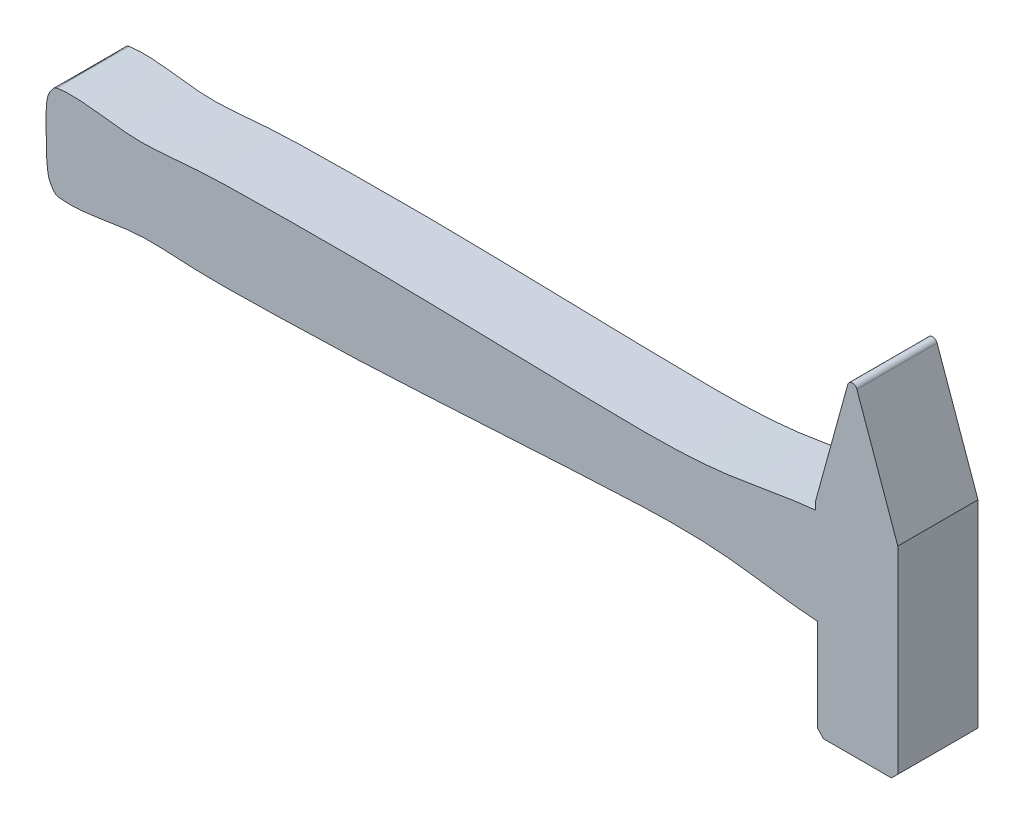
SolidWorks part; units mm, degrees
ref_plane "Plan de face" through (0, 0, 0) normal (0, 0, 1) x (1, 0, 0)
ref_plane "Plan de dessus" through (0, 0, 0) normal (0, 1, 0) x (1, 0, 0)
ref_plane "Plan de droite" through (0, 0, 0) normal (1, 0, 0) x (0, 0, -1)
sketch "Esquisse1" plane through (0, 0, 0) normal (0, 0, 1) x (1, 0, 0)
  line L0 (-388.3824, 105.6296) -> (139.5327, 89.0392) construction
  line L1 (0, 0) -> (0, 38.5055)
  line L2 (-284.6368, 70.5412) -> (-284.0031, 36.3588) construction
  line L3 (-284.32, 53.45) -> (83.1514, 59.7883) construction
  line L4 (0, 0) -> (2.5793, -2.6388)
  line L5 (2.5793, -2.6388) -> (30.8284, -2.6388)
  line L6 (30.8284, -2.6388) -> (33.5282, 0)
  line L7 (33.5282, 0) -> (33.5282, 82.3612)
  line L8 (33.5282, 82.3612) -> (14.3545, 136.3624)
  line L9 (14.3545, 136.3624) -> (-0.6845, 81.6961)
  line L10 (-0.6845, 81.6961) -> (-0.6845, 78.1908)
  spline S0 degree 3 poles (0, 38.5055) (-12.9929, 39.2651) (-32.8726, 43.1724) (-62.3228, 43.9918) (-92.949, 42.4953) (-137.6271, 40.0452) (-185.3014, 37.0157) (-228.8924, 35.9277) (-258.7667, 35.3214) (-283.1784, 37.5067) (-301.2471, 33.5502) (-312.0118, 32.8896) (-316.1547, 33.3659) knots 0 0 0 0 0.123174 0.190952 0.278444 0.413498 0.614695 0.730776 0.826275 0.897915 0.961055 1 1 1 1
  spline S1 degree 3 poles (-321.2186, 52.8135) (-321.2038, 49.4201) (-321.1659, 44.1912) (-320.2878, 37.7067) (-318.2147, 34.6903) (-316.9069, 33.4524) (-316.1547, 33.3659) knots 0 0 0 0 0.479345 0.759128 0.899247 1 1 1 1
  spline S2 degree 3 poles (-0.6845, 78.1908) (-13.6435, 76.9835) (-33.3766, 72.393) (-62.7811, 70.5584) (-93.4407, 70.9979) (-138.1766, 71.9057) (-185.927, 73.2892) (-229.5297, 72.8734) (-259.4071, 72.449) (-283.7289, 69.4231) (-301.9233, 72.7541) (-312.7044, 73.0431) (-316.8284, 72.4242) knots 0 0 0 0 0.123174 0.190952 0.278444 0.413498 0.614695 0.730776 0.826275 0.897915 0.961055 1 1 1 1
  spline S3 degree 3 poles (-321.2186, 52.8135) (-321.3208, 56.2054) (-321.4633, 61.4325) (-320.8093, 67.9435) (-318.8415, 71.0295) (-317.5772, 72.3118) (-316.8284, 72.4242) knots 0 0 0 0 0.479345 0.759128 0.899247 1 1 1 1
  point P48 (14.3545, 136.3624)
  point P49 (0, 0)
  dimension "D1" = 85
extrude "Boss.-Extru.1" add sketch "Esquisse1" along normal blind 33.4
fillet "Congé1" radius 2 1 edges at (14.3545, 136.3624, 16.7)
sketch "Esquisse3" plane through (0, 0, 0) normal (0, 0, -1) x (-1, 0, 0)
  line L0 (0.6845, 78.1908) -> (0, 38.5055)
  spline S0 degree 3 poles (1821.4053, 1371.5832) (234.0768, 135.7105) (329.4558, 105.4099) (320.2878, 37.7067) (311.9389, 25.5588) (284.8584, 23.9977) (-421.6905, 1891.8404) knots -8.489598 -8.489598 -8.489598 -8.489598 0.479345 0.759128 0.899247 2.576173 2.576173 2.576173 2.576173 only from (321.2186, 52.8135) to (316.1547, 33.3659) construction
  spline S1 degree 3 poles (-484.7359, -1759.6556) (285.8724, 82.8663) (312.8842, 80.3723) (320.8093, 67.9435) (327.6371, -0.036) (231.2688, -27.0292) (1775.056, -1316.9272) knots -1.57622 -1.57622 -1.57622 -1.57622 0.100753 0.240872 0.520655 9.489642 9.489642 9.489642 9.489642 only from (316.8284, 72.4242) to (321.2186, 52.8135) construction
  spline S2 degree 3 poles (565.7215, 2015.0683) (436.0771, 76.8606) (360.1971, 20.6419) (283.1784, 37.5067) (258.7667, 35.3214) (228.8924, 35.9277) (185.3014, 37.0157) (137.6271, 40.0452) (92.949, 42.4953) (62.3228, 43.9918) (-71.2563, 40.275) (-183.5802, -89.9499) (-497.8856, 1967.6109) knots -0.566785 -0.566785 -0.566785 -0.566785 0.038945 0.102085 0.173725 0.269224 0.385305 0.586502 0.721556 0.809048 0.876826 1.984512 1.984512 1.984512 1.984512 only from (316.1547, 33.3659) to (0, 38.5055) construction
  spline S3 degree 3 poles (-563.4396, -1832.6312) (-178.3577, 212.9022) (-70.5911, 78.8798) (62.7811, 70.5584) (93.4407, 70.9979) (138.1766, 71.9057) (185.927, 73.2892) (229.5297, 72.8734) (259.4071, 72.449) (283.7289, 69.4231) (361.2838, 83.6218) (435.1803, 24.8191) (497.9057, -1916.7394) knots -0.984518 -0.984518 -0.984518 -0.984518 0.123174 0.190952 0.278444 0.413498 0.614695 0.730776 0.826275 0.897915 0.961055 1.566789 1.566789 1.566789 1.566789 only from (0.6845, 78.1908) to (316.8284, 72.4242) construction
  spline S4 degree 3 poles (321.2186, 52.8135) (321.2038, 49.4201) (321.1659, 44.1912) (320.2878, 37.7067) (318.2147, 34.6903) (316.9069, 33.4524) (316.1547, 33.3659) knots 0 0 0 0 0.479345 0.759128 0.899247 1 1 1 1
  spline S5 degree 3 poles (316.8284, 72.4242) (317.5772, 72.3118) (318.8415, 71.0295) (320.8093, 67.9435) (321.4633, 61.4325) (321.3208, 56.2054) (321.2186, 52.8135) knots 0 0 0 0 0.100753 0.240872 0.520655 1 1 1 1
  spline S6 degree 3 poles (316.1547, 33.3659) (312.0118, 32.8896) (301.2471, 33.5502) (283.1784, 37.5067) (258.7667, 35.3214) (228.8924, 35.9277) (185.3014, 37.0157) (137.6271, 40.0452) (92.949, 42.4953) (62.3228, 43.9918) (32.8726, 43.1724) (12.9929, 39.2651) (0, 38.5055) knots 0 0 0 0 0.038945 0.102085 0.173725 0.269224 0.385305 0.586502 0.721556 0.809048 0.876826 1 1 1 1
  spline S7 degree 3 poles (0.6845, 78.1908) (13.6435, 76.9835) (33.3766, 72.393) (62.7811, 70.5584) (93.4407, 70.9979) (138.1766, 71.9057) (185.927, 73.2892) (229.5297, 72.8734) (259.4071, 72.449) (283.7289, 69.4231) (301.9233, 72.7541) (312.7044, 73.0431) (316.8284, 72.4242) knots 0 0 0 0 0.123174 0.190952 0.278444 0.413498 0.614695 0.730776 0.826275 0.897915 0.961055 1 1 1 1
extrude "Enlèv. mat.-Extru.1" cut sketch "Esquisse3" against normal blind 3.33
